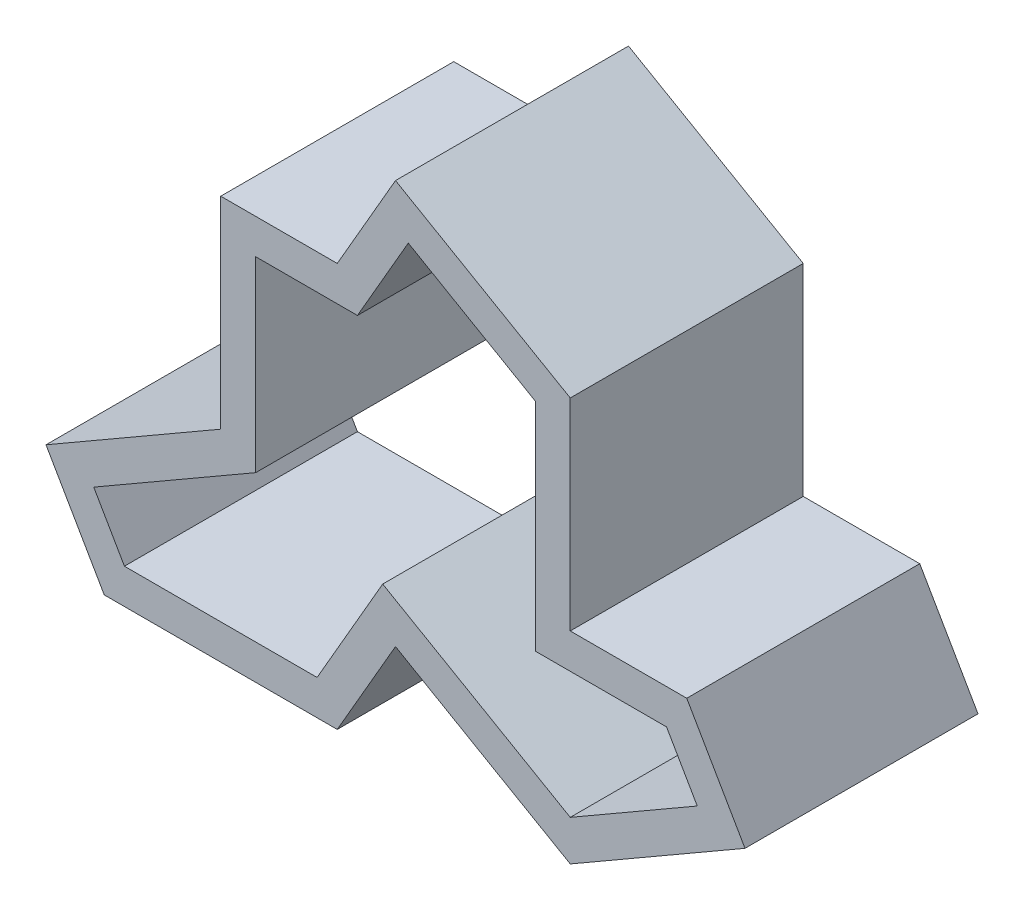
SolidWorks part; units mm, degrees
ref_plane "Přední rovina" through (0, 0, 0) normal (0, 0, 1) x (1, 0, 0)
ref_plane "Horní rovina" through (0, 0, 0) normal (0, 1, 0) x (1, 0, 0)
ref_plane "Pravá rovina" through (0, 0, 0) normal (1, 0, 0) x (0, 0, -1)
sketch "Skica1"
sketch_block_instance "Blok2-1"
sketch_block "Blok2" parameters "D1"=20
extrude "Přidat vysunutím1" add sketch "Skica1" along normal blind 20
